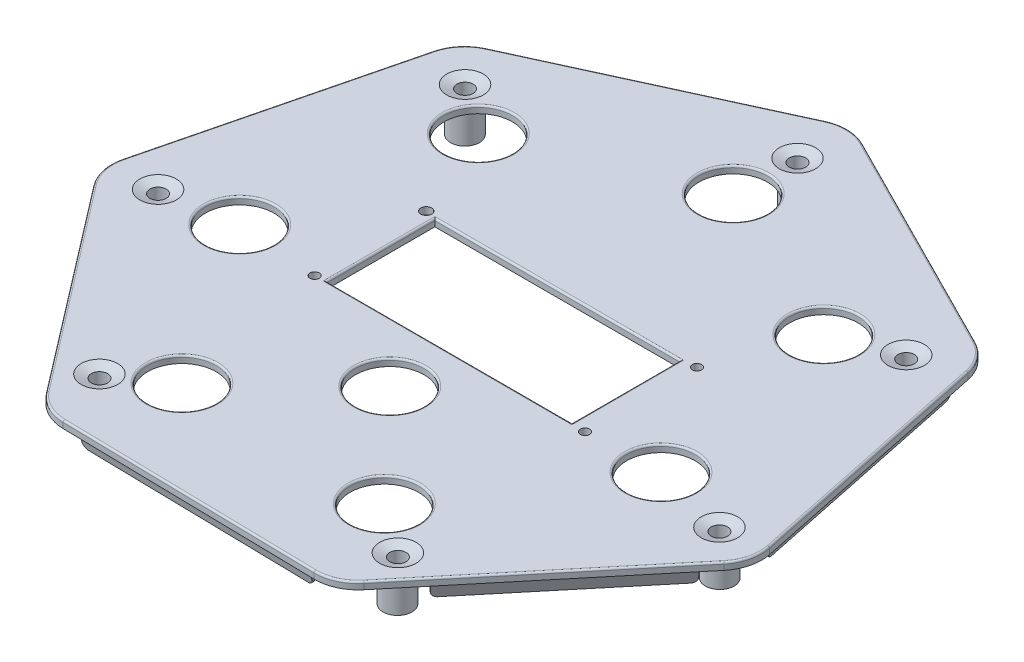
SolidWorks part; units mm, degrees
ref_plane "Ebene vorne" through (0, 0, 0) normal (0, 0, 1) x (1, 0, 0)
ref_plane "Ebene oben" through (0, 0, 0) normal (0, 1, 0) x (1, 0, 0)
ref_plane "Ebene rechts" through (0, 0, 0) normal (1, 0, 0) x (0, 0, -1)
sketch "Skizze3" plane through (0, -203.7496, 0) normal (0, 1, 0) x (1, 0, 0)
  line L1 (1.8217, 95.0338) -> (-73.1646, 60.6768)
  line L2 (-73.1646, 60.6768) -> (-93.0565, -19.371)
  line L3 (-93.0565, -19.371) -> (-42.8749, -84.8321)
  line L4 (-42.8749, -84.8321) -> (39.5923, -86.4129)
  line L5 (39.5923, -86.4129) -> (92.2457, -22.923)
  line L6 (92.2457, -22.923) -> (75.4362, 57.8284)
  line L7 (75.4362, 57.8284) -> (1.8217, 95.0338)
  circle A0 centre (0, 0) radius 85.6357 construction
extrude "Deckel" add sketch "Skizze3" along normal blind 2 separate body
sketch "Skizze4" plane through (0, -201.7496, 0) normal (0, 1, 0) x (1, 0, 0)
  line L1 (34, -15) -> (-34, -15)
  line L2 (34, -15) -> (34, 15)
  line L3 (34, 15) -> (-34, 15)
  line L4 (-34, -15) -> (-34, 15)
  line L5 (34, -15) -> (-34, 15) construction
  line L6 (34, 15) -> (-34, -15) construction
  circle A0 centre (38.0123, -15.3737) radius 1.3
  circle A1 centre (38.0223, 15.6278) radius 1.3
  circle A2 centre (-36.9897, 15.6092) radius 1.5
  circle A3 centre (-36.9592, -15.3715) radius 1.3
  point P0 (0, 0)
  dimension "D3" = 3
  dimension "D1" = 68
  dimension "D2" = 30
extrude "Schnitt-Linear austragen1" cut sketch "Skizze4" against normal blind 5
sketch "Skizze11" plane through (0, -201.7496, 0) normal (0, 1, 0) x (1, 0, 0)
  circle A0 centre (1.3589, 62.3327) radius 9.4972
  circle A1 centre (47.7208, 41.1118) radius 9.5
  circle A2 centre (-48.4302, 41.4668) radius 9.5
  circle A3 centre (-59.5896, -13.5014) radius 9.5
  circle A4 centre (-29.5312, -59.5857) radius 9.5
  circle A5 centre (27.4745, -60.4741) radius 9.5
  circle A6 centre (58.2459, -14.5691) radius 9.5
extrude "Schnitt-Linear austragen6" cut sketch "Skizze11" against normal blind 2
sketch "Skizze12" plane through (0, -201.7496, 0) normal (0, 1, 0) x (1, 0, 0)
  circle A0 centre (0, -31.4992) radius 9.5
extrude "Schnitt-Linear austragen7" cut sketch "Skizze12" against normal blind 10
fillet "Verrundung1" radius 12 1 edges at (-42.8749, -202.7496, 84.8321)
fillet "Verrundung2" radius 12 1 edges at (39.5923, -202.7496, 86.4129)
fillet "Verrundung3" radius 12 1 edges at (92.2457, -202.7496, 22.923)
fillet "Verrundung4" radius 12 1 edges at (75.4362, -202.7496, -57.8284)
fillet "Verrundung5" radius 12 1 edges at (-93.0565, -202.7496, 19.371)
fillet "Verrundung6" radius 12 1 edges at (-73.1646, -202.7496, -60.6768)
sketch "Skizze15" plane through (0, -201.7496, 0) normal (0, 1, 0) x (1, 0, 0)
  circle A0 centre (79.7257, -19.7482) radius 4
  circle A1 centre (64.0906, 47.6905) radius 4
  circle A2 centre (1.856, 79.7994) radius 4
  circle A3 centre (-62.0262, 51.3727) radius 4
  circle A4 centre (-79.2765, -16.3576) radius 4
  circle A5 centre (41.2851, -70.6359) radius 4
  circle A6 centre (-42.9782, -68.7891) radius 4
extrude "Aufsatz-Linear austragen2" add sketch "Skizze15" against normal blind 12
sketch "Skizze16" plane through (0, -201.7496, 0) normal (0, 1, 0) x (1, 0, 0)
  circle A0 centre (79.5673, -19.6734) radius 2.25
  circle A1 centre (41.128, -70.3696) radius 2.25
  circle A2 centre (-43.1559, -68.8138) radius 2.25
  circle A3 centre (-79.3287, -16.3845) radius 2.25
  circle A4 centre (-61.9868, 51.3582) radius 2.25
  circle A5 centre (1.7985, 79.7266) radius 2.25
  circle A6 centre (64.0686, 47.5855) radius 2.25
extrude "Schnitt-Linear austragen8" cut sketch "Skizze16" against normal blind 12
chamfer "Fase1" distance 2.8 angle 20 7 edges at (-79.3287, -201.7496, 18.6345) (-43.1559, -201.7496, 71.0638) (41.128, -201.7496, 72.6196) (79.5673, -201.7496, 21.9234) (64.0686, -201.7496, -45.3355) (1.7985, -201.7496, -77.4766) (-61.9868, -201.7496, -49.1082)
fillet "Verrundung9" radius 0.5 10 edges at (34, -201.7496, 0) (0, -201.7496, -15) (-34, -201.7496, 0) (0, -201.7496, 15) (-59.5896, -201.7496, 23.0014) (0, -201.7496, 40.9992) (58.2459, -201.7496, 24.0691) (47.7208, -201.7496, -31.6118) (1.3589, -201.7496, -52.8356) (-48.4302, -201.7496, -31.9668)
fillet "Verrundung10" radius 0.5 2 edges at (27.4745, -201.7496, 69.9741) (-29.5312, -201.7496, 69.0857)
fillet "Verrundung12" radius 12 1 edges at (1.8217, -202.7496, -95.0338)
fillet "Verrundung17" radius 0.5 14 edges at (-1.6413, -201.7496, 85.6225) (-42.2799, -201.7496, 83.6549) (65.919, -201.7496, 54.6679) (39.0429, -201.7496, 85.2138) (83.841, -201.7496, -17.4527) (90.9657, -201.7496, 22.6049) (38.6289, -201.7496, -76.4311) (74.3894, -201.7496, -57.0259) (-67.9657, -201.7496, 52.1015) (-91.7651, -201.7496, 19.1022) (-83.1105, -201.7496, -20.6529) (-72.1493, -201.7496, -59.8348) (-35.6715, -201.7496, -77.8553) (1.7964, -201.7496, -93.715)
sketch "Skizze18" plane through (0, -203.7496, 0) normal (0, -1, 0) x (1, 0, 0)
  line L0 (-42.8749, 84.8321) -> (39.5923, 86.4129) construction
  line L1 (-41.8736, 82.8509) -> (-90.8832, 18.9186)
  line L2 (-90.8832, 18.9186) -> (-71.4559, -59.2598)
  line L3 (-71.4559, -59.2598) -> (1.7791, -92.8144)
  line L4 (1.7791, -92.8144) -> (73.6745, -56.4778)
  line L5 (73.6745, -56.4778) -> (90.0914, 22.3877)
  line L6 (90.0914, 22.3877) -> (38.6677, 84.3948)
  line L7 (38.6677, 84.3948) -> (-41.8736, 82.8509)
  line L8 (-46.8892, 76.3081) -> (-86.4347, 24.7217)
  line L9 (-46.8892, 76.3081) -> (-44.5083, 74.4829)
  line L10 (-86.4347, 24.7217) -> (-84.0537, 22.8965)
  line L11 (-44.5083, 74.4829) -> (-84.0537, 22.8965)
  line L12 (-34.7842, 82.9868) -> (30.2158, 84.2328)
  line L13 (-34.7842, 82.9868) -> (-34.7267, 79.9874)
  line L14 (30.2158, 84.2328) -> (30.2733, 81.2333)
  line L15 (-34.7267, 79.9874) -> (30.2733, 81.2333)
  line L16 (50.273, 70.4011) -> (83.9975, 29.7357)
  line L17 (50.273, 70.4011) -> (47.9638, 68.486)
  line L18 (83.9975, 29.7357) -> (81.6883, 27.8206)
  line L19 (47.9638, 68.486) -> (81.6883, 27.8206)
  line L20 (74.991, -50.1534) -> (88.2377, 13.4825)
  line L21 (74.991, -50.1534) -> (72.0539, -49.542)
  line L22 (88.2377, 13.4825) -> (85.3006, 14.0939)
  line L23 (72.0539, -49.542) -> (85.3006, 14.0939)
  line L24 (68.6745, -59.0049) -> (10.6627, -88.3245)
  line L25 (68.6745, -59.0049) -> (67.3212, -56.3274)
  line L26 (10.6627, -88.3245) -> (9.3095, -85.647)
  line L27 (67.3212, -56.3274) -> (9.3095, -85.647)
  line L28 (-4.4859, -89.9439) -> (-63.5786, -62.869)
  line L29 (-4.4859, -89.9439) -> (-3.2363, -87.2165)
  line L30 (-63.5786, -62.869) -> (-62.329, -60.1416)
  line L31 (-3.2363, -87.2165) -> (-62.329, -60.1416)
  line L32 (-74.3751, -47.5127) -> (-87.4925, 5.2739)
  line L33 (-74.3751, -47.5127) -> (-71.4636, -46.7892)
  line L34 (-87.4925, 5.2739) -> (-84.581, 5.9974)
  line L35 (-71.4636, -46.7892) -> (-84.581, 5.9974)
  circle A0 centre (0, 0) radius 83.6382 construction
  dimension "D1" = 2
  dimension "D2" = 65
  dimension "D3" = 3
  dimension "D4" = 65
  dimension "D5" = 3
  dimension "D6" = 3
  dimension "D7" = 3
  dimension "D8" = 3
  dimension "D9" = 65
  dimension "D10" = 65
  dimension "D11" = 52.8301
  dimension "D12" = 3
  dimension "D13" = 65
  dimension "D14" = 3
  dimension "D15" = 54.392
extrude "Aufsatz-Linear austragen3" add sketch "Skizze18" along normal blind 5 contours L25 L27 L26 L4 | L29 L31 L30 L3 | L23 L21 L5 L22 | L17 L19 L18 L6 | L13 L15 L14 L7 | L11 L9 L1 L10 | L32 L33 L35 L34
chamfer "Fase2" distance 5 angle 15 6 edges at (-34.0323, -208.7496, -76.4064) (39.6686, -208.7496, -73.6647) (81.6143, -208.7496, -18.3354) (67.1353, -208.7496, 50.0684) (-2.2842, -208.7496, 83.6098) (-66.6619, -208.7496, 50.5149)
chamfer "Fase3" distance 5 angle 15 1 edges at (-80.9338, -208.7496, -21.1194)
fillet "Verrundung22" radius 1.5 1 edges at (30.2733, -206.2496, 81.2333)
fillet "Verrundung23" radius 1.5 3 edges at (-2.9766, -208.7496, 80.596) (30.243, -208.7496, 82.8132) (29.8256, -208.7496, 81.6642)
fillet "Verrundung24" radius 1.5 3 edges at (-34.757, -208.7496, 81.5672) (-34.7267, -205.4996, 79.9874) (-34.7351, -208.3102, 80.4266)
fillet "Verrundung25" radius 1.5 1 edges at (-84.7126, -208.7496, 23.4015)
fillet "Verrundung26" radius 1.5 1 edges at (-45.1671, -208.7496, 74.988)
fillet "Verrundung27" radius 1.5 5 edges at (-84.0537, -205.4996, 22.8965) (-83.7865, -208.3102, 23.2452) (-64.281, -208.7496, 48.6897) (-44.5083, -205.4996, 74.4829) (-44.7756, -208.3102, 74.1342)
fillet "Verrundung28" radius 1.5 1 edges at (64.826, -208.7496, 48.1533)
fillet "Verrundung29" radius 1.5 3 edges at (82.9046, -208.7496, 28.8293) (81.6883, -205.4996, 27.8206) (82.0265, -208.3102, 28.1011)
fillet "Verrundung30" radius 1.5 3 edges at (49.1801, -208.7496, 69.4947) (47.9638, -205.4996, 68.486) (48.3019, -208.3102, 68.7664)
fillet "Verrundung31" radius 1.5 1 edges at (78.6773, -208.7496, -17.7241)
fillet "Verrundung32" radius 1.5 3 edges at (73.6009, -208.7496, -49.864) (72.0539, -205.4996, -49.542) (72.4841, -208.3102, -49.6315)
fillet "Verrundung33" radius 1.5 3 edges at (86.8476, -208.7496, 13.7719) (85.3006, -205.4996, 14.0939) (85.7308, -208.3102, 14.0044)
fillet "Verrundung34" radius 1.5 1 edges at (38.3154, -208.7496, -70.9872)
fillet "Verrundung35" radius 1.5 3 edges at (68.034, -208.7496, -57.7377) (67.3212, -205.4996, -56.3274) (67.5194, -208.3102, -56.7195)
fillet "Verrundung36" radius 1.5 3 edges at (10.0223, -208.7496, -87.0573) (9.3095, -205.4996, -85.647) (9.5077, -208.3102, -86.0392)
fillet "Verrundung37" radius 1.5 1 edges at (-3.5821, -208.7496, -87.9712)
fillet "Verrundung38" radius 1.5 3 edges at (-33.4645, -208.7496, -73.3667) (-3.2363, -205.4996, -87.2165) (-3.6357, -208.3102, -87.0335)
fillet "Verrundung39" radius 1.5 3 edges at (-62.9872, -208.7496, -61.5781) (-62.329, -205.4996, -60.1416) (-62.512, -208.3102, -60.541)
fillet "Verrundung40" radius 1.5 1 edges at (-72.2692, -208.7496, -46.9894)
fillet "Verrundung41" radius 1.5 3 edges at (-78.2032, -208.7496, -19.6681) (-71.4636, -205.4996, -46.7892) (-71.5696, -208.3102, -46.3628)
fillet "Verrundung42" radius 1.5 3 edges at (-86.1145, -208.7496, 5.6163) (-84.581, -205.4996, 5.9974) (-85.0074, -208.3102, 5.8914)
